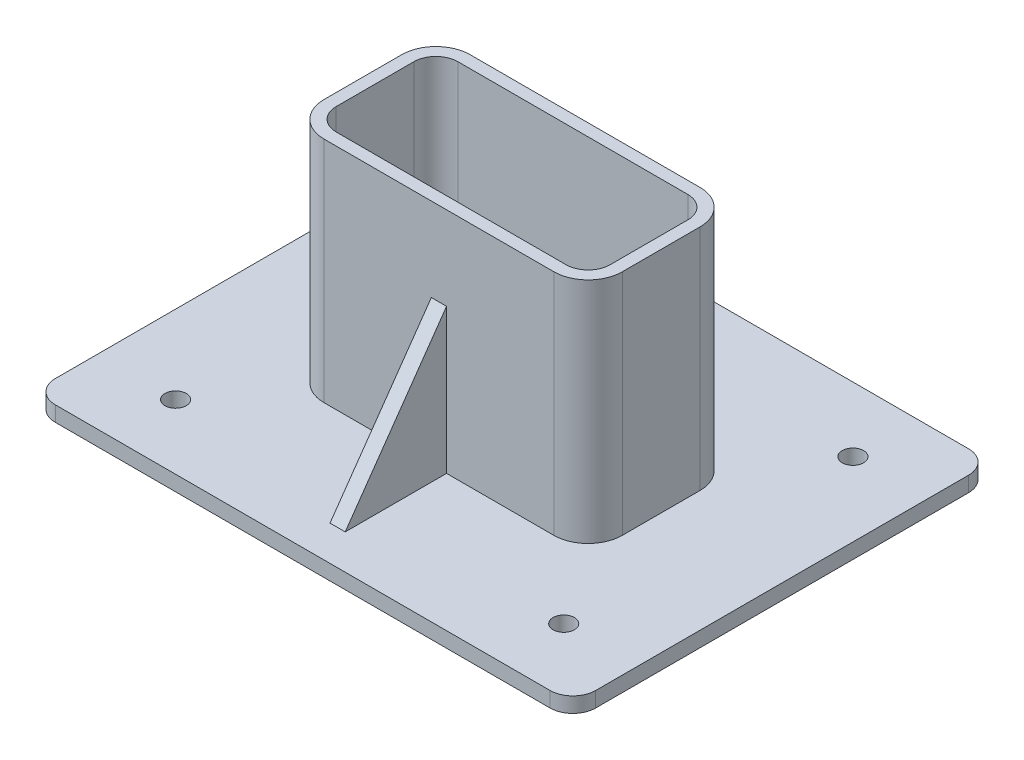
SolidWorks part; units mm, degrees
ref_plane "Alzado" through (0, 0, 0) normal (0, 0, 1) x (1, 0, 0)
ref_plane "Planta" through (0, 0, 0) normal (0, 1, 0) x (1, 0, 0)
ref_plane "Vista lateral" through (0, 0, 0) normal (1, 0, 0) x (0, 0, -1)
sketch "Croquis2" plane through (0, 0, 0) normal (0, 1, 0) x (1, 0, 0)
  line L0 (0, 222.285) -> (0, -222.285) construction
  line L1 (343.7936, 0) -> (-343.7936, 0) construction
  line L21 (-75.5, 40) -> (75.5, 40)
  line L23 (90, 25.5) -> (90, -25.5)
  line L40 (-75.5, 48) -> (75.5, 48)
  line L41 (98, 25.5) -> (98, -25.5)
  line L42 (-98, 25.5) -> (-98, -25.5)
  line L43 (-90, 25.5) -> (-90, -25.5)
  line L44 (90, 25.5) -> (90, -25.5)
  line L45 (98, 25.5) -> (98, -25.5)
  line L46 (-98, 25.5) -> (-98, -25.5)
  line L47 (-90, 25.5) -> (-90, -25.5)
  line L48 (90, 25.5) -> (90, -25.5)
  line L49 (98, 25.5) -> (98, -25.5)
  line L50 (-98, 25.5) -> (-98, -25.5)
  line L51 (-90, 25.5) -> (-90, -25.5)
  line L52 (90, 25.5) -> (90, -25.5)
  line L53 (98, 25.5) -> (98, -25.5)
  line L54 (-98, 25.5) -> (-98, -25.5)
  line L55 (-90, 25.5) -> (-90, -25.5)
  line L56 (-75.5, -48) -> (75.5, -48)
  line L57 (-75.5, -40) -> (75.5, -40)
  arc A49 (98, 25.5) -> (75.5, 48) centre (75.5, 25.5) ccw
  arc A50 (90, 25.5) -> (75.5, 40) centre (75.5, 25.5) ccw
  arc A51 (-90, 25.5) -> (-75.5, 40) centre (-75.5, 25.5) cw
  arc A52 (-98, 25.5) -> (-75.5, 48) centre (-75.5, 25.5) cw
  arc A53 (98, 25.5) -> (75.5, 48) centre (75.5, 25.5) ccw
  arc A54 (90, 25.5) -> (75.5, 40) centre (75.5, 25.5) ccw
  arc A55 (-90, 25.5) -> (-75.5, 40) centre (-75.5, 25.5) cw
  arc A56 (-98, 25.5) -> (-75.5, 48) centre (-75.5, 25.5) cw
  arc A57 (98, 25.5) -> (75.5, 48) centre (75.5, 25.5) ccw
  arc A58 (90, 25.5) -> (75.5, 40) centre (75.5, 25.5) ccw
  arc A59 (-90, 25.5) -> (-75.5, 40) centre (-75.5, 25.5) cw
  arc A60 (-98, 25.5) -> (-75.5, 48) centre (-75.5, 25.5) cw
  arc A61 (98, 25.5) -> (75.5, 48) centre (75.5, 25.5) ccw
  arc A62 (90, 25.5) -> (75.5, 40) centre (75.5, 25.5) ccw
  arc A63 (-90, 25.5) -> (-75.5, 40) centre (-75.5, 25.5) cw
  arc A64 (-98, 25.5) -> (-75.5, 48) centre (-75.5, 25.5) cw
  arc A65 (-98, -25.5) -> (-75.5, -48) centre (-75.5, -25.5) ccw
  arc A66 (-90, -25.5) -> (-75.5, -40) centre (-75.5, -25.5) ccw
  arc A67 (90, -25.5) -> (75.5, -40) centre (75.5, -25.5) cw
  arc A68 (98, -25.5) -> (75.5, -48) centre (75.5, -25.5) cw
  arc A69 (-98, -25.5) -> (-75.5, -48) centre (-75.5, -25.5) ccw
  arc A70 (-90, -25.5) -> (-75.5, -40) centre (-75.5, -25.5) ccw
  arc A71 (90, -25.5) -> (75.5, -40) centre (75.5, -25.5) cw
  arc A72 (98, -25.5) -> (75.5, -48) centre (75.5, -25.5) cw
  arc A73 (-98, -25.5) -> (-75.5, -48) centre (-75.5, -25.5) ccw
  arc A74 (-90, -25.5) -> (-75.5, -40) centre (-75.5, -25.5) ccw
  arc A75 (90, -25.5) -> (75.5, -40) centre (75.5, -25.5) cw
  arc A76 (98, -25.5) -> (75.5, -48) centre (75.5, -25.5) cw
  arc A77 (-98, -25.5) -> (-75.5, -48) centre (-75.5, -25.5) ccw
  arc A78 (-90, -25.5) -> (-75.5, -40) centre (-75.5, -25.5) ccw
  arc A79 (90, -25.5) -> (75.5, -40) centre (75.5, -25.5) cw
  arc A80 (98, -25.5) -> (75.5, -48) centre (75.5, -25.5) cw
  point P4 (0, 0)
  point P7 (0, 0)
  point P9 (0, -40)
  point P10 (-98, 0)
  point P12 (90, 0)
  point P22 (98, 0)
  point P23 (0, 48)
  point P24 (0, 40)
  point P34 (-90, 0)
  point P35 (0, -48)
  dimension "D3" = 8
  dimension "D4" = 22.5
  dimension "D1" = 48
  dimension "D2" = 98
extrude "Saliente-Extruir2" add sketch "Croquis2" along normal blind 150 contours A68 L41 A49 L40 A52 L42 A65 L56 L23 A67 L57 A66 L43 A51 L21 A50
sketch "Croquis4" plane through (0, 0, 0) normal (0, 1, 0) x (1, 0, 0)
  line L1 (177.5, -137.5) -> (-177.5, -137.5)
  line L2 (177.5, -137.5) -> (177.5, 137.5)
  line L3 (177.5, 137.5) -> (-177.5, 137.5)
  line L4 (-177.5, -137.5) -> (-177.5, 137.5)
  line L5 (177.5, -137.5) -> (-177.5, 137.5) construction
  line L6 (177.5, 137.5) -> (-177.5, -137.5) construction
  point P0 (0, 0)
  dimension "D1" = 275
  dimension "D2" = 355
extrude "Saliente-Extruir3" add sketch "Croquis4" against normal blind 10
fillet "Redondeo1" radius 15 4 edges at (177.5, -5, 137.5) (177.5, -5, -137.5) (-177.5, -5, -137.5) (-177.5, -5, 137.5)
sketch "Croquis5" plane through (0, 0, 0) normal (0, 1, 0) x (1, 0, 0)
  line L0 (-162.5, -122.5) -> (197.5751, 148.9412) construction
  line L1 (-229.1354, 168.7699) -> (163.3461, -120.3127) construction
  line L2 (-126.0204, -95) -> (-126.0204, 156.5965) construction
  line L4 (128.9796, -95) -> (128.9796, 156.5965) construction
  line L6 (128.9796, 97.2308) -> (-162.5, 97.2308) construction
  line L7 (0, 0) -> (65.8481, 0) construction
  circle A6 centre (128.9796, 95) radius 7
  circle A7 centre (-126.0204, -95) radius 7
  circle A8 centre (128.9796, -95) radius 7
  circle A10 centre (-126.0204, 95) radius 7
  dimension "D1" = 95
  dimension "D2" = 14
  dimension "D4" = 95
  dimension "D6" = 255
extrude "Cortar-Extruir1" cut sketch "Croquis5" against normal through all
sketch "Croquis6" plane through (0, 0, 0) normal (1, 0, 0) x (0, 0, -1)
  line L0 (-48, 95.084) -> (-114.5786, 0)
  line L1 (-48, 150) -> (-48, 0) construction
  line L2 (-122.5, 0) -> (122.5, 0) construction
  line L3 (0, 150) -> (0, 0) construction
  line L4 (25.5, 150) -> (-25.5, 150) construction
  dimension "D1" = 55
  dimension "D2" = 95.084
rib "Nervio5" sketch "Croquis6" sketch "Croquis6" thickness 10 extrusion direction parallel to sketch draft on no parameters "D1"=10
mirror "Simetría1" about plane through (0, 0, 0) normal (0, 0, 1) of "Nervio5"
